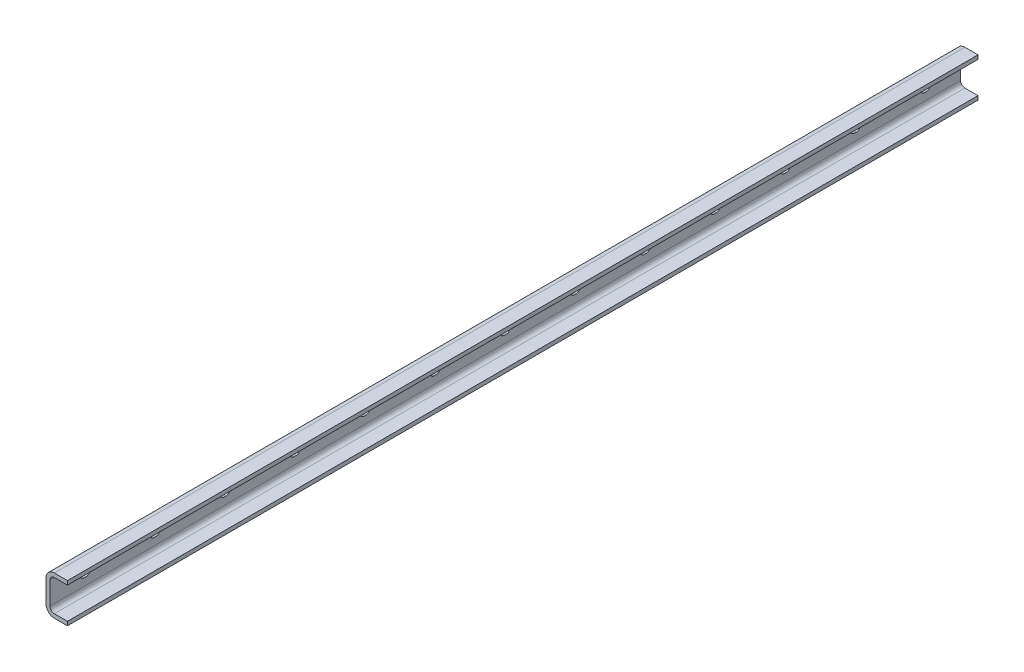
SolidWorks part; units mm, degrees
ref_plane "Front Plane" through (0, 0, 0) normal (0, 0, 1) x (1, 0, 0)
ref_plane "Top Plane" through (0, 0, 0) normal (0, 1, 0) x (1, 0, 0)
ref_plane "Right Plane" through (0, 0, 0) normal (1, 0, 0) x (0, 0, -1)
sketch "Sketch1" plane through (0, 0, 0) normal (0, 0, 1) x (1, 0, 0)
  line L0 (24.5, 17.9) -> (24.5, 22.4)
  line L1 (24.5, 22.4) -> (9.5, 22.4)
  line L2 (0, 12.9) -> (0, -12.9)
  line L3 (9.5, -22.4) -> (24.5, -22.4)
  line L4 (24.5, -22.4) -> (24.5, -17.9)
  line L5 (24.5, -17.9) -> (9.5, -17.9)
  line L6 (4.5, -12.9) -> (4.5, 12.9)
  line L7 (9.5, 17.9) -> (24.5, 17.9)
  arc A0 (9.5, 22.4) -> (0, 12.9) centre (9.5, 12.9) ccw
  arc A1 (0, -12.9) -> (9.5, -22.4) centre (9.5, -12.9) ccw
  arc A2 (9.5, -17.9) -> (4.5, -12.9) centre (9.5, -12.9) cw
  arc A3 (4.5, 12.9) -> (9.5, 17.9) centre (9.5, 12.9) cw
  dimension "D1" = 9.5
  dimension "D2" = 5
  dimension "D3" = 24.5
  dimension "D4" = 17.9
  dimension "D5" = 17.9
extrude "Extrude1" add sketch "Sketch1" against normal blind 1040
sketch "Sketch2" plane through (4.5, 0, 0) normal (1, 0, 0) x (0, 0, -1)
  line L0 (39, 0) -> (41, 0) construction
  line L1 (39, 4.5) -> (41, 4.5)
  line L2 (39, -4.5) -> (41, -4.5)
  arc A0 (39, 4.5) -> (39, -4.5) centre (39, 0) ccw
  arc A1 (41, 4.5) -> (41, -4.5) centre (41, 0) cw
  point P9 (40, 0)
  dimension "D1" = 2
  dimension "D2" = 9
  dimension "D3" = 40
extrude "Extrude2" cut sketch "Sketch2" against normal through all
pattern_linear "LPattern1" count 13 spacing 80 along (0, 0, -1) of "Extrude2"
